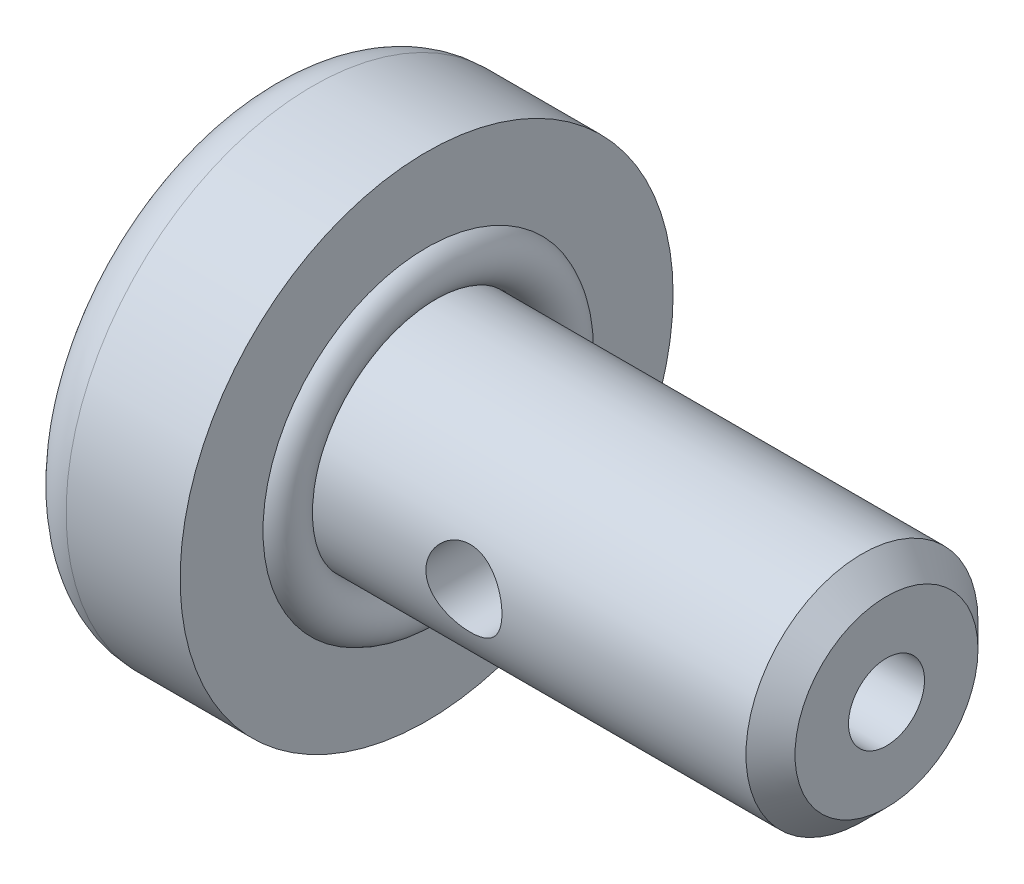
SolidWorks part; units mm, degrees
ref_plane "Plane1" through (0, 0, 0) normal (0, 0, 1) x (1, 0, 0)
ref_plane "Plane2" through (0, 0, 0) normal (0, 1, 0) x (1, 0, 0)
ref_plane "Plane3" through (0, 0, 0) normal (1, 0, 0) x (0, 0, -1)
sketch "Sketch1" plane through (0, 0, 0) normal (0, 0, 1) x (1, 0, 0)
  line L0 (0, 0) -> (4.8309, 0)
  line L1 (12.9032, 0.7874) -> (12.9032, 2.4033)
  line L2 (12.9032, 2.4033) -> (3.2059, 2.4033)
  line L3 (3.3782, 3.3892) -> (3.3782, 5.1054)
  line L4 (0, 0) -> (0, 4.0894)
  line L5 (3.3782, 5.1054) -> (1.016, 5.1054)
  line L6 (0, 0) -> (-10.7648, 0) construction
  line L7 (12.9032, 0.7874) -> (5.2832, 0.7874)
  line L8 (5.2832, 0.7874) -> (4.8309, 0)
  arc A0 (1.016, 5.1054) -> (0, 4.0894) centre (1.016, 4.0894) ccw
  arc A1 (3.2059, 2.4033) -> (3.3782, 3.3892) centre (3.2059, 2.9113) ccw
  dimension "D1" = 1.016
  dimension "D6" = 0.508
  dimension "D2" = 3.3782
  dimension "D3" = 5.1054
  dimension "D4" = 9.525
  dimension "D5" = 2.4033
  dimension "D7" = 0.7874
  dimension "D8" = 7.62
revolve "Base-Revolve" add sketch "Sketch1" angle 360 about L6
chamfer "Chamfer1" distance 0.508 angle 45
sketch "Sketch2" plane through (0, 0, 0) normal (0, 0, 1) x (1, 0, 0)
  line L0 (0, 0) -> (6.5532, 0) construction
  line L1 (12.3952, 0) -> (12.9032, 0) construction
  line L2 (12.9032, -1.8953) -> (12.9032, 1.8953) construction
  circle A0 centre (6.5532, 0) radius 0.7874
  dimension "D1" = 6.35
extrude "Cut-Extrude1" cut sketch "Sketch2" against normal through all and the other way through all
sketch "Sketch3" plane through (0, 0, 0) normal (-1, 0, 0) x (0, 0, 1)
sketch "Hexagon - circumscribed2" plane through (0, -0.3283, -0.2445) normal (-1, 0, 0) x (0, 0, 1)
  line L0 (-0.6721, 1.9158) -> (1.161, 1.9158)
  line L1 (1.161, 1.9158) -> (2.0776, 0.3283)
  line L2 (2.0776, 0.3283) -> (1.161, -1.2592)
  line L3 (1.161, -1.2592) -> (-0.6721, -1.2592)
  line L4 (-0.6721, -1.2592) -> (-1.5886, 0.3283)
  line L5 (-1.5886, 0.3283) -> (-0.6721, 1.9158)
  circle A0 centre (0.2445, 0.3283) radius 1.5875 construction
  dimension "D1" = 3.175
extrude "Cut-Extrude2" cut sketch "Hexagon - circumscribed2" against normal blind 3.175
